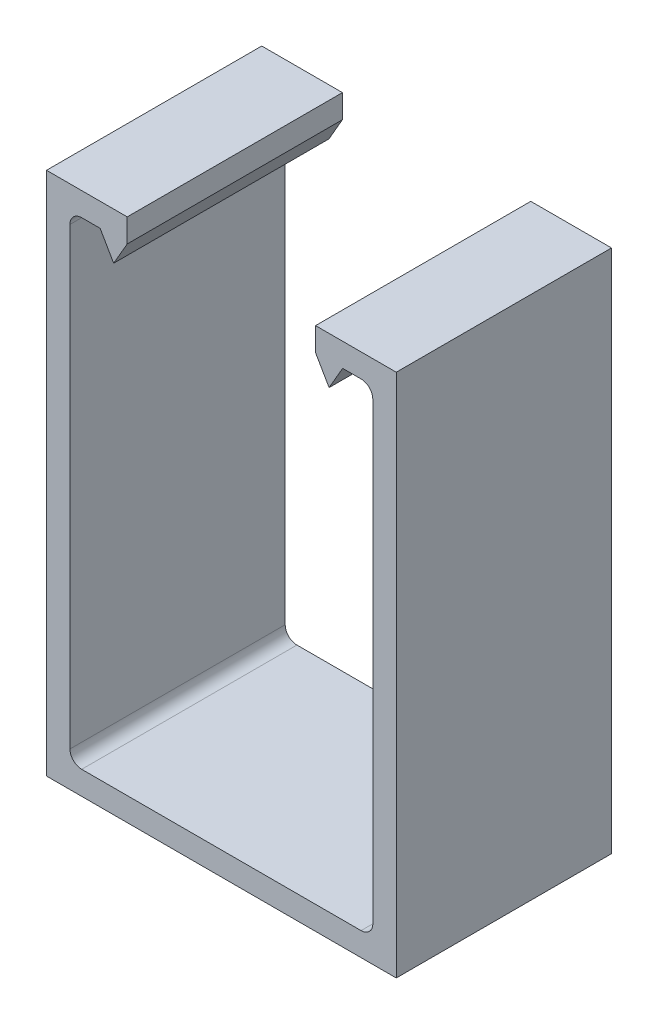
SolidWorks part; units mm, degrees
ref_plane "Plane1" through (0, 0, 0) normal (0, 0, 1) x (1, 0, 0)
ref_plane "Plane2" through (0, 0, 0) normal (0, 1, 0) x (1, 0, 0)
ref_plane "Plane3" through (0, 0, 0) normal (1, 0, 0) x (0, 0, -1)
sketch "Sketch1" plane through (0, 0, 0) normal (0, 0, 1) x (1, 0, 0)
  line L0 (-11.1125, 30.9562) -> (-20.6375, 30.9562)
  line L1 (-20.6375, 30.9562) -> (-20.6375, -30.9562)
  line L2 (-20.6375, -30.9562) -> (20.6375, -30.9562)
  line L3 (20.6375, -30.9562) -> (20.6375, 30.9563)
  line L4 (20.6375, 30.9563) -> (11.1125, 30.9563)
  line L5 (16.4846, 28.1877) -> (14.3094, 28.1877)
  line L6 (17.8689, -26.8033) -> (17.8689, 26.8034)
  line L7 (-16.4846, -28.1876) -> (16.4846, -28.1876)
  line L8 (-17.8689, 26.8033) -> (-17.8689, -26.8033)
  line L9 (-14.3094, 28.1876) -> (-16.4846, 28.1876)
  line L10 (14.3094, 28.1877) -> (12.711, 25.4191)
  line L11 (12.711, 25.4191) -> (11.1125, 28.1877)
  line L12 (11.1125, 28.1877) -> (11.1125, 30.9563)
  line L13 (-14.3094, 28.1876) -> (-12.711, 25.419)
  line L14 (-12.711, 25.419) -> (-11.1125, 28.1876)
  line L15 (-11.1125, 28.1876) -> (-11.1125, 30.9562)
  arc A0 (-17.8689, -26.8033) -> (-16.4846, -28.1876) centre (-16.4846, -26.8033) ccw
  arc A1 (-16.4846, 28.1876) -> (-17.8689, 26.8033) centre (-16.4846, 26.8033) ccw
  arc A2 (17.8689, 26.8034) -> (16.4846, 28.1877) centre (16.4846, 26.8034) ccw
  arc A3 (16.4846, -28.1876) -> (17.8689, -26.8033) centre (16.4846, -26.8033) ccw
  dimension "D5" = 1.3843
  dimension "D4" = 60
  dimension "Width" = 41.275
  dimension "Height" = 61.9125
  dimension "D8" = 20.6375
  dimension "D9" = 30.9562
  dimension "D10" = 22.225
  dimension "edge" = 9.525
  dimension "D13" = 1.5985
extrude "Base-Extrude" add sketch "Sketch1" along normal mid plane 25.4
equation "\"D8@Sketch1\" = \"Width@Sketch1\" / 2"
equation "\"D9@Sketch1\" = \"Height@Sketch1\" / 2"
equation "\"D10@Sketch1\" = \"Width@Sketch1\" - 2 * \"edge@Sketch1\""
equation "\"D5@Sketch1\" = \"gauge@Sketch1\" / 2"
equation "\"D13@Sketch1\" = \"gauge@Sketch1\" * .577350269"
